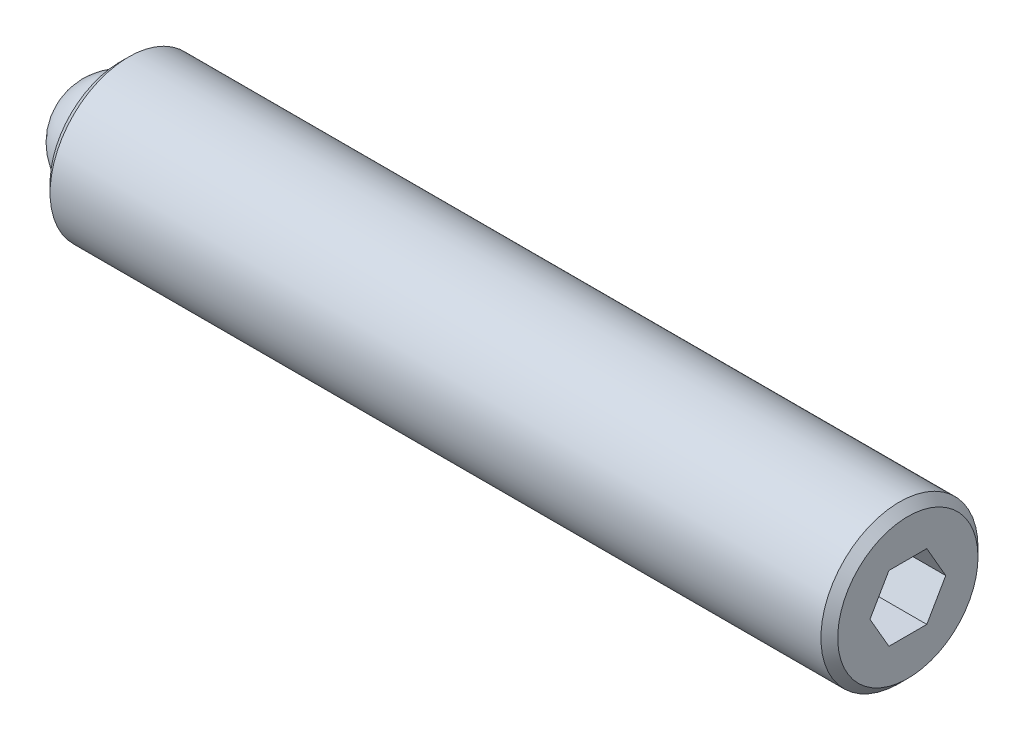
SolidWorks part; units mm, degrees
ref_plane "Front Plane" through (0, 0, 0) normal (0, 0, 1) x (1, 0, 0)
ref_plane "Top Plane" through (0, 0, 0) normal (0, 1, 0) x (1, 0, 0)
ref_plane "Right Plane" through (0, 0, 0) normal (1, 0, 0) x (0, 0, -1)
sketch "Sketch2" plane through (0, 0, 0) normal (1, 0, 0) x (0, 0, -1)
  circle A0 centre (0, 0) radius 2.3749
  dimension "D1" = 4.7498
extrude "Boss-Extrude1" add sketch "Sketch2" along normal blind 23.8125
sketch "Sketch3" plane through (0, 0, 0) normal (-1, 0, 0) x (0, 0, 1)
  circle A0 centre (0, 0) radius 1.5875
  dimension "D1" = 3.175
chamfer "Chamfer1" distance 0.254 angle 45 1 edges at (0, 0, -2.3749)
chamfer "Chamfer2" distance 0.254 angle 45 1 edges at (23.8125, 0, -2.3749)
sketch "Sketch4" plane through (23.8125, 0, 0) normal (1, 0, 0) x (0, 0, -1)
  line L1 (1.1457, 0) -> (0.5728, 0.9922)
  line L2 (0.5728, 0.9922) -> (-0.5728, 0.9922)
  line L3 (-0.5728, 0.9922) -> (-1.1457, 0)
  line L4 (-1.1457, 0) -> (-0.5728, -0.9922)
  line L5 (-0.5728, -0.9922) -> (0.5728, -0.9922)
  line L6 (0.5728, -0.9922) -> (1.1457, 0)
  circle A0 centre (0, 0) radius 0.9922 construction
extrude "Cut-Extrude2" cut sketch "Sketch4" against normal blind 2.286
extrude "Cut-Extrude3" cut sketch "Sketch3" against normal blind 1.5875
sketch "Sketch5" plane through (0, 0, 0) normal (-1, 0, 0) x (0, 0, 1)
  line L0 (0, 0) -> (0, -1.5875)
  line L1 (0, 0) -> (0, 1.5875)
  arc A0 (0, 1.5875) -> (0, -1.5875) centre (0, 0) ccw
revolve "Revolve1" add sketch "Sketch5" angle 360 about L1
sketch "Sketch6" plane through (0, 0, 0) normal (-1, 0, 0) x (0, 0, 1)
  line L0 (0, 0) -> (0, 1.5875) construction
  arc A0 (0.0635, 1.5862) -> (-0.0635, 1.5862) centre (0, 0) ccw
  circle A1 centre (0, 0) radius 1.5875 construction
  circle A3 centre (0, 0) radius 1.5875 construction
  arc A4 (0.0635, 1.5862) -> (-0.0635, 1.5862) centre (0, 1.5875) ccw
  dimension "D1" = 0.127
extrude "Cut-Extrude6" cut sketch "Sketch6" against normal blind 1.5875
